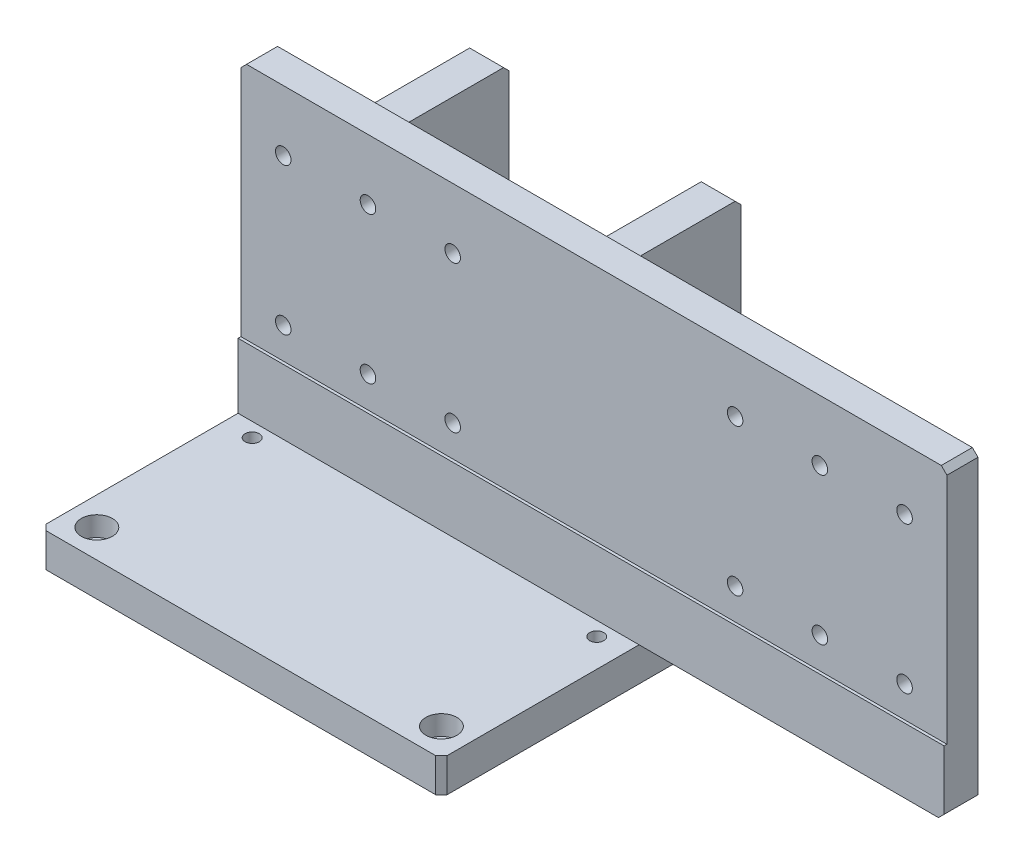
SolidWorks part; units mm, degrees
ref_plane "정면" through (0, 0, 0) normal (0, 0, 1) x (1, 0, 0)
ref_plane "윗면" through (0, 0, 0) normal (0, 1, 0) x (1, 0, 0)
ref_plane "우측면" through (0, 0, 0) normal (1, 0, 0) x (0, 0, -1)
sketch "스케치1" plane through (0, 0, 0) normal (0, 1, 0) x (1, 0, 0)
  line L1 (-71, 65) -> (71, 65)
  line L2 (-71, 65) -> (-71, -65)
  line L3 (-71, -65) -> (71, -65)
  line L4 (71, 65) -> (71, -65)
  line L5 (-71, 65) -> (71, -65) construction
  line L6 (-71, -65) -> (71, 65) construction
  point P0 (0, 0)
  dimension "D1" = 142
  dimension "D2" = 130
extrude "보스-돌출1" add sketch "스케치1" along normal blind 12
sketch "스케치2" plane through (0, 12, 0) normal (0, 1, 0) x (1, 0, 0)
  line L0 (-71, 65) -> (-71, -65) construction
  line L1 (-71, 17) -> (179, 17)
  line L2 (-71, 17) -> (-71, 5)
  line L3 (-71, 5) -> (179, 5)
  line L4 (179, 17) -> (179, 5)
  line L5 (71, 65) -> (-71, 65) construction
  dimension "D1" = 250
  dimension "D2" = 12
  dimension "D3" = 48
extrude "보스-돌출2" add sketch "스케치2" along normal blind 107.5 separate body
sketch "스케치3" plane through (0, 0, -5) normal (0, 0, 1) x (1, 0, 0)
  line L0 (179, 119.5) -> (179, 12) construction
  line L1 (-71, 119.5) -> (179, 119.5)
  line L2 (-71, 119.5) -> (-71, 35)
  line L3 (-71, 35) -> (179, 35)
  line L4 (179, 119.5) -> (179, 35)
  line L5 (-71, 0) -> (71, 0) construction
  dimension "D1" = 35
  dimension "D2" = 250
extrude "컷-돌출1" cut sketch "스케치3" against normal blind 1
sketch "스케치4" plane through (0, 12, 0) normal (0, 1, 0) x (1, 0, 0)
  line L0 (71, 65) -> (-71, 65) construction
  line L1 (-47, 65) -> (-35, 65)
  line L2 (-47, 65) -> (-47, 17)
  line L3 (-47, 17) -> (-35, 17)
  line L4 (-35, 65) -> (-35, 17)
  line L5 (179, 17) -> (-71, 17) construction
  line L6 (71, -65) -> (71, 65) construction
  line L7 (35, 65) -> (47, 65)
  line L8 (35, 65) -> (35, 17)
  line L9 (35, 17) -> (47, 17)
  line L10 (47, 65) -> (47, 17)
  dimension "D1" = 24
  dimension "D2" = 12
  dimension "D3" = 70
extrude "보스-돌출3" add sketch "스케치4" along normal blind 95 separate body
sketch "스케치5" plane through (47, 0, 0) normal (1, 0, 0) x (0, 0, -1)
  line L0 (65, 107) -> (65, 105)
  line L1 (65, 107) -> (65, 12) construction
  line L2 (65, 105) -> (63, 107)
  line L3 (17, 107) -> (65, 107) construction
  line L4 (63, 107) -> (65, 107)
  dimension "D1" = 2
  dimension "D2" = 2
extrude "컷-돌출2" cut sketch "스케치5" against normal through all
hole_wizard "M6 소켓 머리 캡 나사용 카운터보어1" positions "스케치6" profile "스케치7" counterbore size "M6" standard "KS"
sketch "스케치6" plane through (0, 12, 0) normal (0, 1, 0) x (1, 0, 0)
  line L0 (-71, 65) -> (-71, -65) construction
  line L1 (-71, -65) -> (71, -65) construction
  point P0 (-61, 55)
  point P2 (61, 55)
  point P4 (-61, -55)
  point P6 (61, -55)
  dimension "D1" = 10
  dimension "D2" = 122
  dimension "D3" = 10
  dimension "D4" = 110
sketch "스케치7" plane through (-61, 12, -55) normal (1, 0, 0) x (0, 0, 1)
  line L0 (0, 0) -> (0, 12)
  line L1 (0, 12) -> (3.3, 12)
  line L3 (3.3, 12) -> (3.3, 7)
  line L4 (3.3, 7) -> (5.5, 7)
  line L5 (5.5, 7) -> (5.5, 0)
  line L7 (5.5, 0) -> (0, 0)
  line L11 (0, -6.35) -> (0, 107.95) construction
  dimension "관통 구멍 지름" = 6.6
  dimension "관통 구멍 깊이" = 12
  dimension "카운터보어 지름" = 11
  dimension "카운터보어 깊이" = 7
hole_wizard "Ø5.0mm 맞춤핀 구멍1" positions "스케치8" profile "스케치9" hole size "Ø5.0" standard "ISO"
sketch "스케치8" plane through (0, 12, 0) normal (0, 1, 0) x (1, 0, 0)
  line L0 (-71, 65) -> (-71, -65) construction
  line L1 (-71, -65) -> (71, -65) construction
  point P0 (-61, 0)
  point P2 (61, 0)
  dimension "D1" = 122
  dimension "D2" = 10
  dimension "D3" = 65
sketch "스케치9" plane through (-61, 12, 0) normal (1, 0, 0) x (0, 0, 1)
  line L0 (0, 0) -> (0, 12)
  line L1 (0, 12) -> (2.5, 12)
  line L2 (2.5, 12) -> (2.5, 0)
  line L5 (2.5, 0) -> (0, 0)
  line L11 (0, -6.35) -> (0, 107.95) construction
  dimension "관통 구멍 지름" = 5
  dimension "관통 구멍 깊이" = 12
hole_wizard "M5 소켓 머리 캡 나사용 카운터보어1" positions "스케치10" profile "스케치11" counterbore size "M5" standard "KS"
sketch "스케치10" plane through (0, 0, -17) normal (0, 0, -1) x (-1, 0, 0)
  line L0 (-179, 119.5) -> (71, 119.5) construction
  line L1 (71, 119.5) -> (71, 12) construction
  point P0 (-4, 98)
  point P2 (26, 98)
  point P4 (56, 98)
  point P6 (-4, 46)
  point P8 (26, 46)
  point P10 (56, 46)
  dimension "D1" = 52
  dimension "D2" = 21.5
  dimension "D3" = 15
  dimension "D4" = 30
  dimension "D5" = 30
sketch "스케치11" plane through (4, 98, -17) normal (1, 0, 0) x (0, 1, 0)
  line L0 (0, 0) -> (0, 82)
  line L1 (0, 82) -> (2.75, 82)
  line L3 (2.75, 82) -> (2.75, 6)
  line L4 (2.75, 6) -> (4.75, 6)
  line L5 (4.75, 6) -> (4.75, 0)
  line L7 (4.75, 0) -> (0, 0)
  line L11 (0, -6.35) -> (0, 107.95) construction
  dimension "관통 구멍 지름" = 5.5
  dimension "관통 구멍 깊이" = 82
  dimension "카운터보어 지름" = 9.5
  dimension "카운터보어 깊이" = 6
pattern_linear "선형 패턴1" count 2 spacing 160 along (1, 0, 0) of "M5 소켓 머리 캡 나사용 카운터보어1"
chamfer "모따기1" distance 2 angle 45 3 edges at (179, 12, -11) (179, 119.5, -11.5) (-71, 119.5, -11.5)
chamfer "모따기2" distance 2 angle 45 4 edges at (-71, 6, -65) (71, 6, -65) (71, 6, 65) (-71, 6, 65)
hole_wizard "M4 나사 구멍1" positions "스케치12" profile "스케치13" tap size "M4" standard "ISO"
sketch "스케치12" plane through (-71, 0, 0) normal (-1, 0, 0) x (0, 0, 1)
  line L0 (-65, 0) -> (-65, 12) construction
  line L1 (-63, 0) -> (63, 0) construction
  point P0 (-51, 6)
  point P2 (-23, 6)
  dimension "D1" = 14
  dimension "D2" = 28
  dimension "D3" = 6
sketch "스케치13" plane through (-71, 6, -51) normal (0, 1, 0) x (0, 0, 1)
  line L0 (0, 0) -> (0, 4.9914)
  line L1 (0, 4.9914) -> (1.65, 4)
  line L2 (1.65, 4) -> (1.65, 0.375)
  line L3 (1.65, 0.375) -> (2.025, 0)
  line L5 (2.025, 0) -> (0, 0)
  line L6 (-1.65, 0.375) -> (-2.025, 0) construction
  line L10 (0, 4.9914) -> (-1.65, 4) construction
  line L11 (0, -6.35) -> (0, 107.95) construction
  dimension "탭 드릴 지름" = 3.3
  dimension "탭 드릴 깊이" = 4
  dimension "표면 카운터싱크 지름" = 4.05
  dimension "표면 카운터싱크 각도" = 90
  dimension "드릴 각도" = 118
